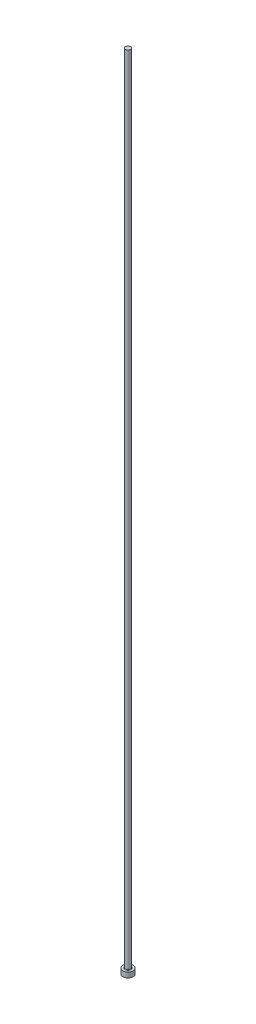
SolidWorks part; units mm, degrees
ref_plane "Plano frontal" through (0, 0, 0) normal (0, 0, 1) x (1, 0, 0)
ref_plane "Plano superior" through (0, 0, 0) normal (0, 1, 0) x (1, 0, 0)
ref_plane "Plano direito" through (0, 0, 0) normal (1, 0, 0) x (0, 0, -1)
sketch "Esboço1" plane through (0, 0, 0) normal (0, 0, 1) x (1, 0, 0)
  line L0 (0, 0) -> (2, 0)
  line L1 (2, 0) -> (2, 2)
  line L2 (2, 2) -> (1.2, 2)
  line L3 (1, 2.2) -> (1, 315)
  line L4 (1, 315) -> (0, 315)
  line L5 (0, 315) -> (0, 0) construction
  line L6 (0, 0) -> (0, 315)
  arc A0 (1.2, 2) -> (1, 2.2) centre (1.2, 2.2) cw
  dimension "D3" = 0.2
  dimension "D1" = 4
  dimension "D2" = 2
  dimension "D4" = 2
  dimension "D5" = 315
revolve "Revolução1" add sketch "Esboço1" angle 360 about L5
sketch "Esboço2"
  dimension "D1" = 1.075
  dimension "D2" = 0.35
  dimension "D3" = 0.225
  dimension "D4" = 0.15
wrap "Envolver1" sketch "Esboço2" wrap type deboss source sketch "Esboço2" thickness 0.1 parameters "D1"=0.1
